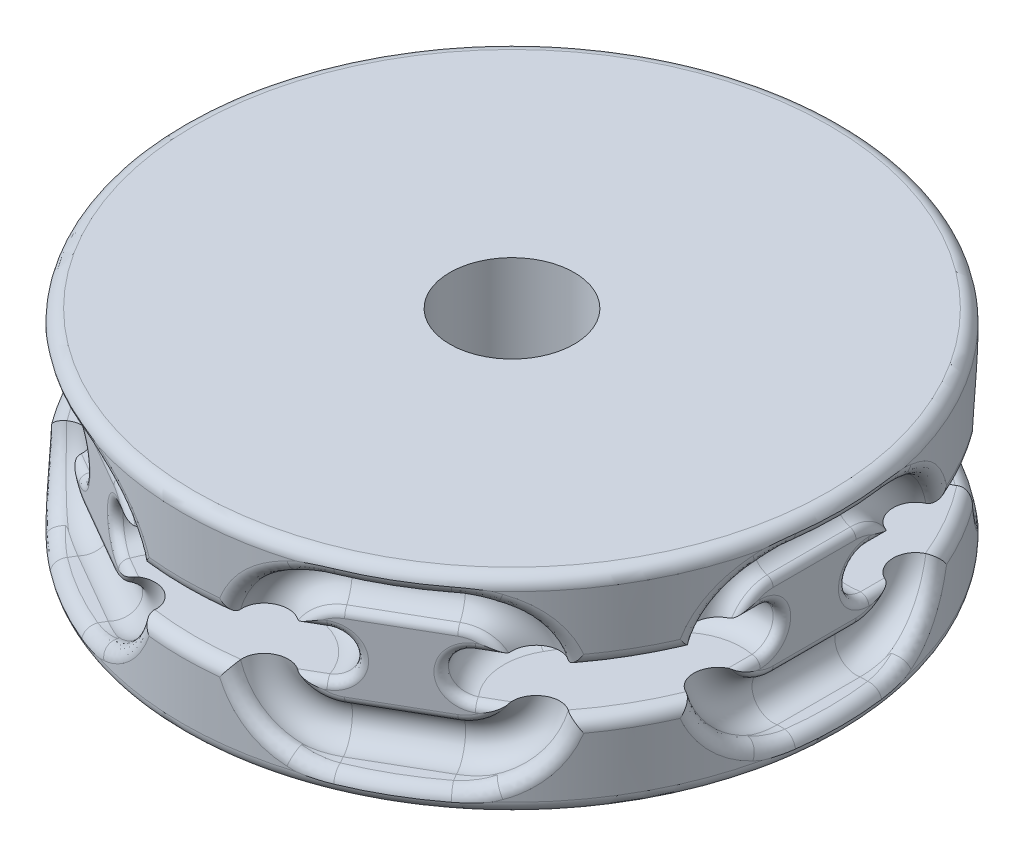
SolidWorks part; units mm, degrees
ref_plane "Ebene vorne" through (0, 0, 0) normal (0, 0, 1) x (1, 0, 0)
ref_plane "Ebene oben" through (0, 0, 0) normal (0, 1, 0) x (1, 0, 0)
ref_plane "Ebene rechts" through (0, 0, 0) normal (1, 0, 0) x (0, 0, -1)
sketch "Skizze1" plane through (0, 0, 0) normal (0, 1, 0) x (1, 0, 0)
  circle A0 centre (0, 0) radius 79.5
  dimension "D1" = 159
extrude "Grundkreis" add sketch "Skizze1" along normal mid plane 50
sketch "Skizze6" plane through (0, 0, 0) normal (0, 1, 0) x (1, 0, 0)
  circle A0 centre (0, 0) radius 15
extrude "Mittelachse" cut sketch "Skizze6" against normal mid plane 67
sketch "Skizze2" plane through (0, 0, 0) normal (0, 1, 0) x (1, 0, 0)
  line L0 (-10, 73) -> (10, 73) construction
  line L1 (-10, 88) -> (10, 88)
  line L2 (-10, 58) -> (10, 58)
  arc A0 (-10, 88) -> (-10, 58) centre (-10, 73) ccw
  arc A1 (10, 58) -> (10, 88) centre (10, 73) ccw
  point P2 (0, 73)
  dimension "D1" = 20
  dimension "D2" = 30
  dimension "D3" = 73
sketch "Skizze3" plane through (0, 0, 0) normal (1, 0, 0) x (0, 0, -1)
  line L0 (88, 0) -> (58, 0) construction
  circle A0 centre (88, 0) radius 5.25
sweep "Maß Kettenglied" cut profiles "Skizze3" path "Skizze2"
sketch "Skizze5" plane through (0, 0, 0) normal (0, 1, 0) x (1, 0, 0)
  line L2 (10, 88) -> (-10, 88)
  line L3 (-10, 58) -> (10, 58)
  line L4 (10, 88) -> (-10, 88)
  line L5 (-10, 58) -> (10, 58)
  arc A2 (10, 58) -> (10, 88) centre (10, 73) ccw
  arc A3 (-10, 88) -> (-10, 58) centre (-10, 73) ccw
  arc A4 (10, 58) -> (10, 88) centre (10, 73) ccw
  arc A5 (-10, 88) -> (-10, 58) centre (-10, 73) ccw
  dimension "D1" = 0
extrude "Senkrechtes Kettenglied " cut sketch "Skizze5" against normal mid plane 10.5
pattern_circular "Kreismuster1" count 6 over 300 about axis through (0, 0, 0) along (0, 1, 0) of "Maß Kettenglied", "Senkrechtes Kettenglied "
ref_plane "Waagrecht Ebende" through (-73, 0, 0) normal (1, 0, 0) x (0, 0, -1)
sketch "Skizze8" plane through (-73, 0, 0) normal (1, 0, 0) x (0, 0, -1)
  line L0 (-10, 0) -> (10, 0) construction
  line L1 (-10, 15) -> (10, 15)
  line L2 (-10, -15) -> (10, -15)
  arc A0 (-10, 15) -> (-10, -15) centre (-10, 0) ccw
  arc A1 (10, -15) -> (10, 15) centre (10, 0) ccw
  point P2 (0, 0)
  dimension "D1" = 20
  dimension "D2" = 30
sketch "Skizze9" plane through (0, 0, 0) normal (0, 0, 1) x (1, 0, 0)
  circle A0 centre (-73, 15) radius 5.1
  dimension "D1" = 10.2
sweep "Schnitt-Austragung1" cut profiles "Skizze9" path "Skizze8"
sketch "Skizze10" plane through (-73, 0, 0) normal (1, 0, 0) x (0, 0, -1)
  line L4 (10, 20) -> (-10, 20)
  line L5 (-10, -20) -> (10, -20)
  line L6 (10, 20) -> (-10, 20)
  line L7 (-10, -20) -> (10, -20)
  arc A4 (10, -20) -> (10, 20) centre (10, 0) ccw
  arc A5 (-10, 20) -> (-10, -20) centre (-10, 0) ccw
  arc A6 (10, -20) -> (10, 20) centre (10, 0) ccw
  arc A7 (-10, 20) -> (-10, -20) centre (-10, 0) ccw
  dimension "D1" = 5
extrude "Öffnung" cut sketch "Skizze10" against normal blind 13
fillet "Verrundung2" radius 2 12 edges at (-73, -8.6598, -14.7977) (-73, -5.25, -16.0075) (-73, 0.8462, -8.2327) (-73, 5.25, -16.0075) (-73, 8.6598, -14.7977) (-73, 9.9, 0) (-73, 8.6598, 14.7977) (-73, 5.25, 16.0075) (-73, 0.7646, 19.2778) (-73, -5.25, 16.0075) (-73, -8.6598, 14.7977) (-73, -9.9, 0)
pattern_circular "Kreismuster2" count 6 over 300 about axis through (0, 0, 0) along (0, 1, 0) of "Öffnung", "Schnitt-Austragung1", "Verrundung2"
fillet "Verrundung1" radius 3 74 edges at (0, 25, 79.5) (0, 5.25, -79.5) (18.6915, 15.6536, -77.2715) (39.75, 20, -68.849) (56.8, 16.4479, -55.6238) (68.849, 5.25, -39.75) (77.3687, 18.2033, -18.2848) (79.5, 20, 0) (76.5717, 16.4479, 21.3783) (68.849, 5.25, 39.75) (54.5195, 18.2033, 57.8608) (39.75, 20, 68.849) (19.7717, 16.4479, 77.0022) (0, 5.25, 79.5) (-22.8492, 18.2033, 76.1457) (-39.75, 20, 68.849) (-55.3152, 17.6777, 57.1006) (-68.849, 5.25, 39.75) (-76.2648, 15.6536, 22.4485) (-79.5, 20, 0) (-77.1082, 17.6777, -19.354) (-68.849, 5.25, -39.75) (-54.5195, 18.2033, -57.8608) (-39.75, 20, -68.849) (-19.7717, 16.4479, -77.0022) (-58.2634, -14.8354, -54.0891) (-68.849, -5.25, -39.75) (-76.2648, -15.6536, -22.4485) (-79.5, -20, 0) (-77.1082, -17.6777, 19.354) (-68.849, -5.25, 39.75) (-57.5733, -15.6536, 54.823) (-39.75, -20, 68.849) (-17.7108, -14.8354, 77.5021) (0, -5.25, 79.5) (19.7074, -16.4035, 77.0186) (39.75, -20, 68.849) (58.2634, -14.8354, 54.0891) (68.849, -5.25, 39.75) (76.5538, -16.4035, 21.4422) (79.5, -20, 0) (75.9742, -14.8354, -23.4131) (68.849, -5.25, -39.75) (56.8464, -16.4035, -55.5764) (39.75, -20, -68.849) (21.793, -17.6777, -76.4547) (0, -5.25, -79.5) (-19.7074, -16.4035, -77.0186) (-39.75, -20, -68.849) (0, -25, 79.5)
